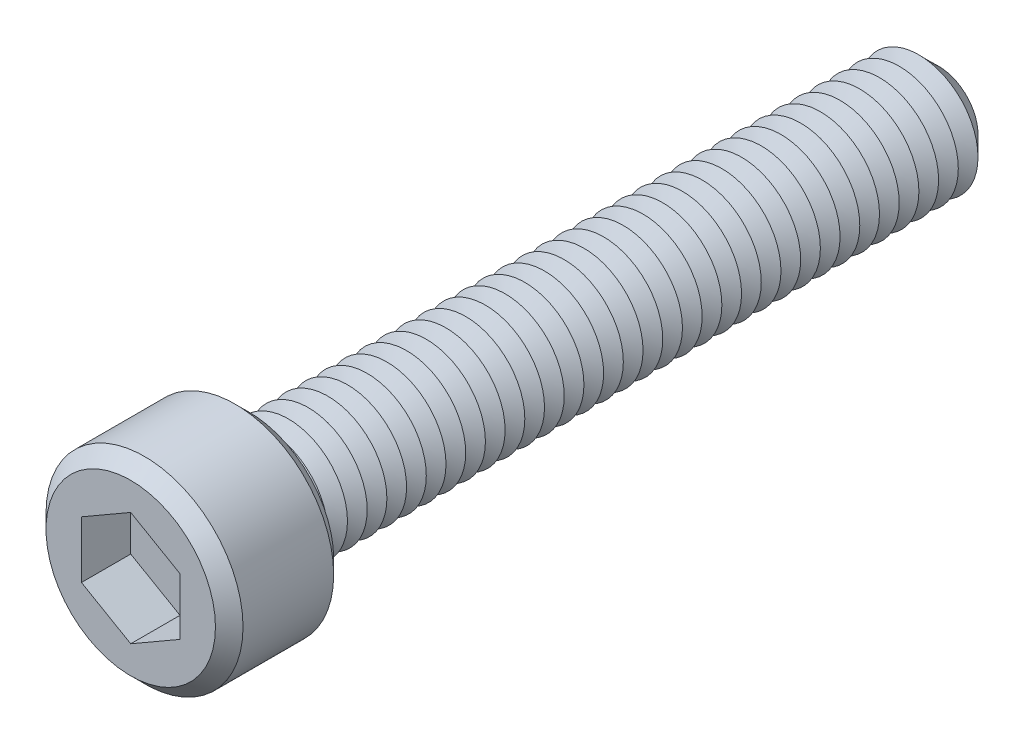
SolidWorks part; units mm, degrees
ref_plane "Front Plane" through (0, 0, 0) normal (0, 0, 1) x (1, 0, 0)
ref_plane "Top Plane" through (0, 0, 0) normal (0, 1, 0) x (1, 0, 0)
ref_plane "Right Plane" through (0, 0, 0) normal (1, 0, 0) x (0, 0, -1)
sketch "Sketch1" plane through (0, 0, 0) normal (0, 0, 1) x (1, 0, 0)
  circle A0 centre (0, 0) radius 5
  dimension "D1" = 10
extrude "Boss-Extrude1" add sketch "Sketch1" along normal blind 6
sketch "Sketch2" plane through (0, 0, 0) normal (0, 0, -1) x (-1, 0, 0)
  circle A0 centre (0, 0) radius 3
  dimension "D1" = 6
extrude "Boss-Extrude2" add sketch "Sketch2" along normal blind 35
chamfer "Chamfer1" distance 1 angle 45 1 edges at (-3, 0, -35)
sketch "Sketch3" plane through (0, 0, 0) normal (1, 0, 0) x (0, 0, -1)
  line L0 (-2.5121, 0) -> (4.5776, 0) construction
sketch "Sketch4" plane through (0, 0, 0) normal (1, 0, 0) x (0, 0, -1)
  line L0 (0, 3) -> (0.5, 2.134)
  line L1 (0.5, 2.134) -> (1, 3)
  line L2 (34, 3) -> (0, 3) construction
  line L3 (1, 3) -> (0, 3)
  dimension "D1" = 1
revolve "Cut-Revolve1" cut sketch "Sketch4" angle 360 about L0
pattern_linear "LPattern1" count 34 spacing 1 along (0, 0, -1) of "Cut-Revolve1"
sketch "Sketch5" plane through (0, 0, 6) normal (0, 0, 1) x (1, 0, 0)
  line L1 (0, 2.8868) -> (-2.5, 1.4434)
  line L2 (-2.5, 1.4434) -> (-2.5, -1.4434)
  line L3 (-2.5, -1.4434) -> (0, -2.8868)
  line L4 (0, -2.8868) -> (2.5, -1.4434)
  line L5 (2.5, -1.4434) -> (2.5, 1.4434)
  line L6 (2.5, 1.4434) -> (0, 2.8868)
  circle A0 centre (0, 0) radius 2.5 construction
  dimension "D1" = 5
extrude "Cut-Extrude1" cut sketch "Sketch5" against normal blind 2.5
sketch "Sketch6" plane through (0, 0, 3.5) normal (0, 0, 1) x (1, 0, 0)
  circle A0 centre (0, 0) radius 0.8
  dimension "D1" = 1.6
extrude "Cut-Extrude2" cut sketch "Sketch6" against normal up to surface (38.5 mm away)
chamfer "Chamfer2" distance 0.7 angle 45 2 edges at (5, 0, 0) (5, 0, 6)
